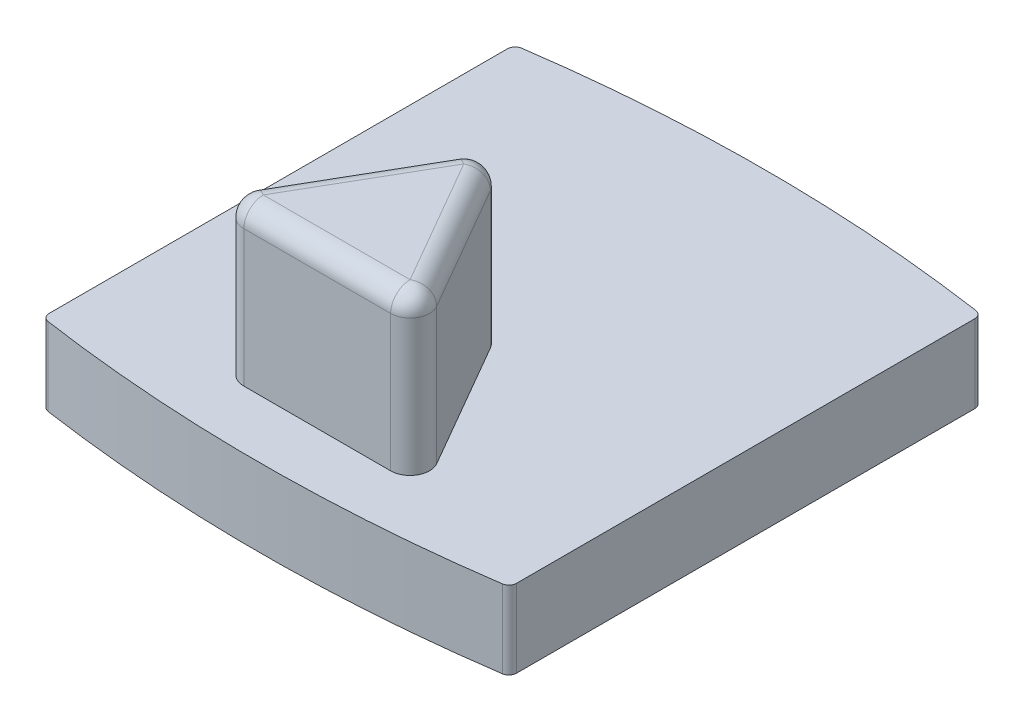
SolidWorks part; units mm, degrees
ref_plane "Front Plane" through (0, 0, 0) normal (0, 0, 1) x (1, 0, 0)
ref_plane "Top Plane" through (0, 0, 0) normal (0, 1, 0) x (1, 0, 0)
ref_plane "Right Plane" through (0, 0, 0) normal (1, 0, 0) x (0, 0, -1)
sketch "Sketch1" plane through (0, 0, 0) normal (0, 1, 0) x (1, 0, 0)
  line L1 (-6, -6.5) -> (6, -6.5)
  line L2 (-6, -6.5) -> (-6, 6.5)
  line L3 (-6, 6.5) -> (6, 6.5)
  line L4 (6, -6.5) -> (6, 6.5)
  line L5 (-6, -6.5) -> (6, 6.5) construction
  line L6 (-6, 6.5) -> (6, -6.5) construction
  point P0 (0, 0)
  dimension "D1" = 12
  dimension "D2" = 13
extrude "Boss-Extrude1" add sketch "Sketch1" along normal blind 2
ref_plane "Plane1" through (0, 0, 0) normal (0, 0, 1) x (1, 0, 0)
sketch "Sketch3" plane through (0, 2, 0) normal (0, 1, 0) x (1, 0, 0)
  line L0 (0, 6.5) -> (0, -34) construction
  line L2 (6, 6.5) -> (-6, 6.5) construction
  line L3 (-55, 0) -> (55, 0) construction
  circle A1 centre (0, -34) radius 40.5
  circle A2 centre (0, -34) radius 45
  circle A3 centre (0, 34) radius 45
  circle A4 centre (0, 34) radius 40.5
  dimension "D1" = 40.5
  dimension "D2" = 90
extrude "Cut-Extrude8" cut sketch "Sketch3" against normal blind 10 contours L0 A4 A1 A3 M16 M15 | L0 A3 A1 A4 M16 M13 | A4 A1 A2 M15 M14 M13 | A1 M14 M15 | A1 M13 M14 | A4 M13 M16 | A4 M16 M15
sketch "Sketch6" plane through (0, 2, 0) normal (0, 1, 0) x (1, 0, 0)
  line L0 (-2.75, -5) -> (2.75, -5)
  line L1 (2.75, -5) -> (0, -0.2369)
  line L2 (0, -0.2369) -> (-2.75, -5)
  point P2 (0, -5)
  dimension "D1" = 5.5
  dimension "D2" = 60
  dimension "D3" = 60
  dimension "D4" = 5
extrude "Boss-Extrude2" add sketch "Sketch6" along normal blind 4
fillet "Fillet1" radius 0.5 3 edges at (0, 4, 0.2369) (-2.75, 4, 5) (2.75, 4, 5)
fillet "Fillet2" radius 0.5 6 edges at (2.317, 6, 4.75) (0, 6, 5) (-2.317, 6, 4.75) (-1.375, 6, 2.6184) (0, 6, 0.7369) (1.375, 6, 2.6184)
fillet "Fillet3" radius 0.2 4 edges at (-6, 1, -6.0531) (6, 1, 6.0531) (-6, 1, 6.0531) (6, 1, -6.0531)
